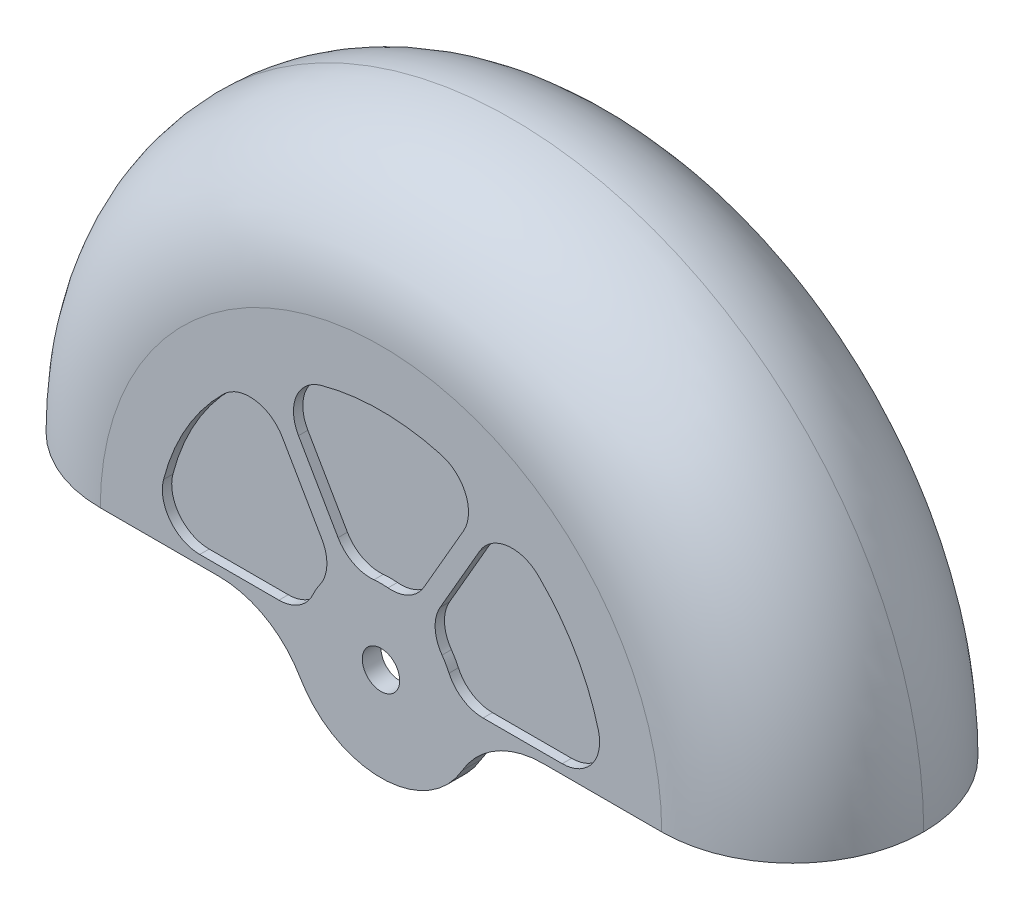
SolidWorks part; units mm, degrees
ref_plane "Front Plane" through (0, 0, 0) normal (0, 0, 1) x (1, 0, 0)
ref_plane "Top Plane" through (0, 0, 0) normal (0, 1, 0) x (1, 0, 0)
ref_plane "Right Plane" through (0, 0, 0) normal (1, 0, 0) x (0, 0, -1)
sketch "Sketch1" plane through (0, 0, 0) normal (0, 0, 1) x (1, 0, 0)
  circle A0 centre (0, 0) radius 110
  dimension "D1" = 220
extrude "Extrude1" add sketch "Sketch1" along normal blind 70
fillet "Fillet1" radius 35 2 edges at (110, 0, 0) (110, 0, 70)
sketch "Sketch2" plane through (0, 0, 0) normal (0, 0, 1) x (1, 0, 0)
  line L0 (43.3013, 0) -> (110, 0)
  line L1 (-110, 0) -> (-43.3013, 0)
  line L2 (-110, 0) -> (-110, -110)
  line L3 (-110, -110) -> (110, -110)
  line L4 (110, 0) -> (110, -110)
  arc A0 (-21.6506, -12.5) -> (21.6506, -12.5) centre (0, 0) ccw
  circle A1 centre (0, 0) radius 110 construction
  arc A2 (-43.3013, 0) -> (-21.6506, -12.5) centre (-43.3013, -25) cw
  arc A3 (43.3013, 0) -> (21.6506, -12.5) centre (43.3013, -25) ccw
  dimension "D1" = 50
  dimension "D2" = 25
extrude "Extrude2" cut sketch "Sketch2" along normal through all
shell "Shell1" thickness 5
sketch "Sketch3" plane through (0, 0, 70) normal (0, 0, 1) x (1, 0, 0)
  circle A0 centre (0, 0) radius 5
  dimension "D1" = 10
extrude "Extrude3" cut sketch "Sketch3" against normal through all
sketch "Sketch5" plane through (0, 0, 70) normal (0, 0, 1) x (1, 0, 0)
  line L3 (-27.2718, 2.5) -> (-48.4123, 2.5)
  line L4 (-11.4708, 24.8681) -> (-22.0411, 43.1763)
  line L5 (27.2718, 2.5) -> (48.4123, 2.5)
  line L8 (-15.801, 22.3681) -> (-26.3712, 40.6763)
  line L9 (11.4708, 24.8681) -> (22.0411, 43.1763)
  line L10 (15.801, 22.3681) -> (26.3712, 40.6763)
  arc A0 (58.0948, 15) -> (42.0378, 42.8115) centre (0, 0) ccw
  arc A1 (18.1812, 8.3333) -> (16.3075, 11.5787) centre (0, 0) ccw
  arc A2 (16.057, 57.8115) -> (-16.057, 57.8115) centre (0, 0) ccw
  arc A3 (1.8737, 19.912) -> (-1.8737, 19.912) centre (0, 0) ccw
  arc A4 (-16.3075, 11.5787) -> (-18.1812, 8.3333) centre (0, 0) ccw
  arc A5 (-27.2718, 2.5) -> (-18.1812, 8.3333) centre (-27.2718, 12.5) ccw
  arc A6 (-42.0378, 42.8115) -> (-58.0948, 15) centre (0, 0) ccw
  arc A7 (-15.801, 22.3681) -> (-16.3075, 11.5787) centre (-24.4612, 17.3681) cw
  arc A8 (-11.4708, 24.8681) -> (-1.8737, 19.912) centre (-2.8106, 29.8681) ccw
  arc A9 (11.4708, 24.8681) -> (1.8737, 19.912) centre (2.8106, 29.8681) cw
  arc A10 (-22.0411, 43.1763) -> (-16.057, 57.8115) centre (-13.3808, 48.1763) cw
  arc A11 (-42.0378, 42.8115) -> (-26.3712, 40.6763) centre (-35.0315, 35.6763) cw
  arc A12 (16.057, 57.8115) -> (22.0411, 43.1763) centre (13.3808, 48.1763) cw
  arc A13 (42.0378, 42.8115) -> (26.3712, 40.6763) centre (35.0315, 35.6763) ccw
  arc A14 (15.801, 22.3681) -> (16.3075, 11.5787) centre (24.4612, 17.3681) ccw
  arc A15 (27.2718, 2.5) -> (18.1812, 8.3333) centre (27.2718, 12.5) cw
  arc A16 (48.4123, 2.5) -> (58.0948, 15) centre (48.4123, 12.5) ccw
  arc A17 (-48.4123, 2.5) -> (-58.0948, 15) centre (-48.4123, 12.5) cw
  point P12 (-12.0866, 15.9347)
  point P13 (20, 2.5)
  point P15 (60, 2.5)
  point P23 (-7.7565, 18.4347)
  point P26 (7.7565, 18.4347)
  dimension "D1" = 120
  dimension "D2" = 40
  dimension "D3" = 10
extrude "Extrude7" cut sketch "Sketch5" against normal blind 2.5
